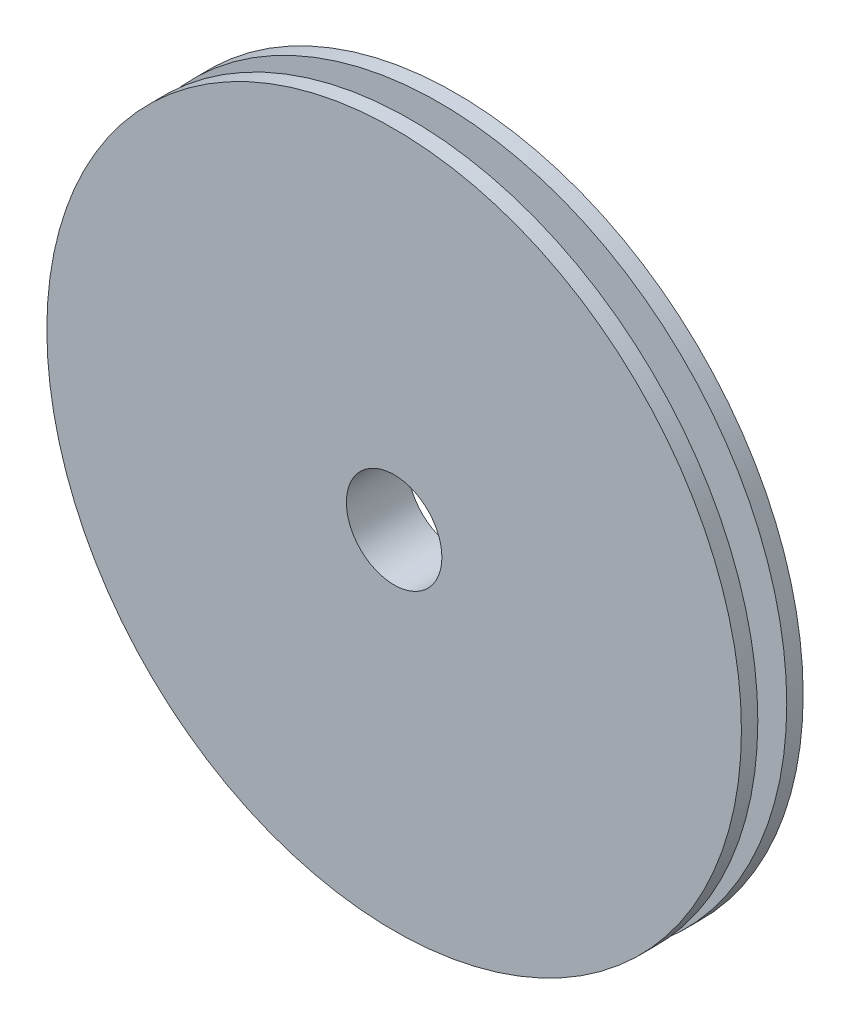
SolidWorks part; units mm, degrees
ref_plane "Front Plane" through (0, 0, 0) normal (0, 0, 1) x (1, 0, 0)
ref_plane "Top Plane" through (0, 0, 0) normal (0, 1, 0) x (1, 0, 0)
ref_plane "Right Plane" through (0, 0, 0) normal (1, 0, 0) x (0, 0, -1)
ref_plane "Plane2" through (0, 0, 30) normal (0, 0, 1) x (1, 0, 0)
sketch "Sketch1" plane through (0, 0, 30) normal (0, 0, 1) x (1, 0, 0)
  circle A0 centre (0, 0) radius 18
  dimension "D1" = 36
extrude "Boss-Extrude1" add sketch "Sketch1" along normal blind 3.2
sketch "Sketch2" plane through (0, 0, 33.2) normal (0, 0, 1) x (1, 0, 0)
  circle A0 centre (0, 0) radius 2.475
  dimension "D1" = 4.95
extrude "Cut-Extrude1" cut sketch "Sketch2" against normal blind 43 and the other way blind 17
ref_plane "Plane1" through (0, 0, 31.6) normal (0, 0, 1) x (1, 0, 0)
sketch "Sketch5" plane through (0, 0, 31.6) normal (0, 0, 1) x (1, 0, 0)
  circle A0 centre (0, 0) radius 18
  circle A1 centre (0, 0) radius 15.5
  dimension "D1" = 2.5
  dimension "D2" = 36
extrude "Cut-Extrude4" cut sketch "Sketch5" against normal mid plane 1.5 contours A1 | A0
